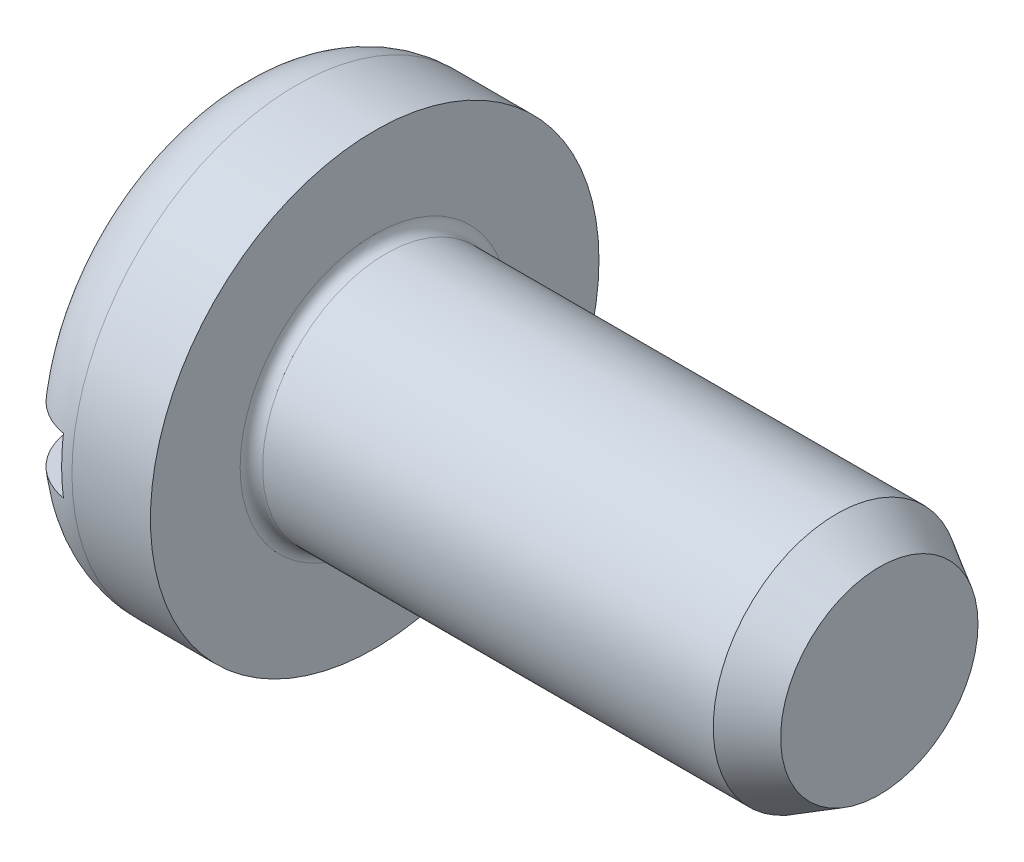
SolidWorks part; units mm, degrees
ref_plane "Front" through (0, 0, 0) normal (0, 0, 1) x (1, 0, 0)
ref_plane "Top" through (0, 0, 0) normal (0, 1, 0) x (1, 0, 0)
ref_plane "Right" through (0, 0, 0) normal (1, 0, 0) x (0, 0, -1)
sketch "Sketch1" plane through (0, 0, 0) normal (0, 0, 1) x (1, 0, 0)
  line L0 (0, 0) -> (0, 2)
  line L1 (0, 2) -> (1.3, 2)
  line L2 (1.3, 2) -> (1.3, 1.1)
  line L4 (1.3, 1.1) -> (5.8, 1.1)
  line L5 (5.8, 1.1) -> (5.8, 0)
  line L6 (5.8, 0) -> (0, 0)
  line L7 (13.1079, 0) -> (-2.2203, 0) construction
  dimension "dk" = 4
  dimension "d" = 2.2
  dimension "k" = 1.3
  dimension "l" = 4.5
revolve "Revolve1" add sketch "Sketch1" angle 360 about L7
chamfer "Chamfer1" distance 0.22 angle 60 1 edges at (5.8, 0, -1.1)
sketch "Sketch6" plane through (0, 0, 0) normal (0, 0, 1) x (1, 0, 0)
  line L0 (2.0155, 0.815) -> (1.5445, 0.815)
  line L1 (1.5445, 0.815) -> (1.38, 1.1)
  line L2 (2.0155, 0.815) -> (2.18, 1.1)
  line L3 (1.38, 1.1) -> (1.38, 1.35)
  line L4 (2.18, 1.1) -> (2.18, 1.35)
  line L5 (1.38, 1.35) -> (2.18, 1.35)
  line L6 (1.78, 0.815) -> (1.78, 0) construction
  line L7 (0, 0) -> (7.3035, 0) construction
  dimension "D1" = 2.2
  dimension "D2" = 60
  dimension "D3" = 0.25
  dimension "threadstart" = 1.78
  dimension "minordia" = 1.63
  dimension "advance" = 0.8
revolve "ThreadSchematic" [suppressed] cut sketch "Sketch6" angle 360 about L7
pattern_linear "ThdSchPat" [suppressed] count 6 spacing 0.8 along (-1, 0, 0)
sketch "Sketch5" plane through (0, 0, 0) normal (0, 0, 1) x (1, 0, 0)
  line L1 (5.8, 1.1) -> (5.8, 0) construction
  line L3 (3.5, -1.1) -> (4, -1.1) construction
  line L4 (0, 0) -> (6.648, 0) construction
  line L5 (5.8, 0) -> (4, -1.1)
  line L6 (5.8, 0) -> (6, 0)
  line L7 (6, 0) -> (6, -1.3)
  line L8 (6, -1.3) -> (4, -1.3)
  line L9 (4, -1.3) -> (4, -1.1)
  line L10 (4, -1.1) -> (6.8602, -1.1) construction
  dimension "D1" = 0.2
  dimension "y" = 2
  dimension "D3" = 0.2
  dimension "D4" = 2.2
revolve "EndCone" [suppressed] cut sketch "Sketch5" angle 360 about L4
fillet "Fillet1" radius 0.1 1 edges at (1.3, 0, -1.1)
fillet "Fillet2" radius 0.6 1 edges at (0, 0, -2)
sketch "Sketch7" plane through (0, 0, 0) normal (0, 0, 1) x (1, 0, 0)
  line L0 (0, 0) -> (-1.1882, 0) construction
  line L1 (-1, 0.25) -> (0.5, 0.25)
  line L2 (-1, 0.25) -> (-1, -0.25)
  line L3 (-1, -0.25) -> (0.5, -0.25)
  line L4 (0.5, 0.25) -> (0.5, -0.25)
  dimension "D1" = 1
  dimension "n" = 0.5
  dimension "t" = 0.5
extrude "Slot" cut sketch "Sketch7" against normal mid plane 30
equation "\"minordia@sketch6\" = \"D2@ThreadCosmetic\""
equation "\"D1@Chamfer1\" = \"d@Sketch1\" / 10"
equation "\"D1@ThdSchPat\" = int((\"l@Sketch1\"/\"advance@Sketch6\") + 0.8)"
equation "\"D3@ThdSchPat\" = \"advance@Sketch6\""
equation "\"D1@Sketch6\" = \"d@Sketch1\""
equation "\"D4@Sketch5\" = \"d@Sketch1\""
equation "\"threadstart@Sketch6\" = \"k@Sketch1\" + \"advance@Sketch6\" * 0.6"
